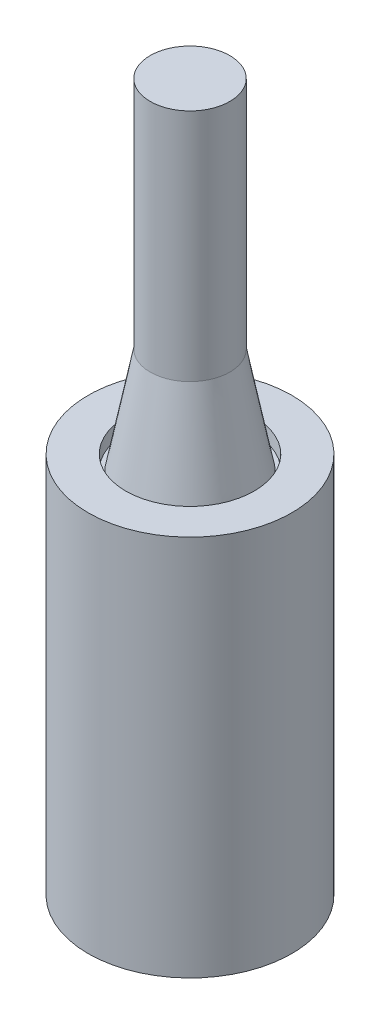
SolidWorks part; units mm, degrees
ref_plane "Front" through (0, 0, 0) normal (0, 0, 1) x (1, 0, 0)
ref_plane "Top" through (0, 0, 0) normal (0, 1, 0) x (1, 0, 0)
ref_plane "Right" through (0, 0, 0) normal (1, 0, 0) x (0, 0, -1)
sketch "Sketch1" plane through (0, 0, 0) normal (0, 1, 0) x (1, 0, 0)
  circle A1 centre (0, 0) radius 7.75
  dimension "D1" = 15.5
extrude "Extrude1" add sketch "Sketch1" along normal blind 18.923
sketch "Sketch2" plane through (0, 18.923, 0) normal (0, 1, 0) x (1, 0, 0)
  circle A0 centre (0, 0) radius 6.55
  dimension "D1" = 13.1
extrude "Extrude2" add sketch "Sketch2" along normal blind 11.43 draft 11
sketch "Sketch3" plane through (0, 30.353, 0) normal (0, 1, 0) x (1, 0, 0)
  circle A1 centre (0, 0) radius 4.3282
  circle A2 centre (0, 0) radius 4.3282
  dimension "D1" = 0
extrude "Extrude3" add sketch "Sketch3" along normal blind 25.5
sketch "Sketch4" plane through (0, 0, 0) normal (0, -1, 0) x (1, 0, 0)
  circle A1 centre (3.81, 0) radius 2.3114
  circle A2 centre (-3.81, 0) radius 2.3114
  circle A4 centre (0, 3.8481) radius 1.5875 construction
  dimension "D1" = 4.6228
  dimension "D2" = 7.747
  dimension "D4" = 12.2428
  dimension "D6" = 3.175
  dimension "D3" = 3.81
extrude "Extrude4" add sketch "Sketch4" along normal blind 6.35
sketch "Sketch5" plane through (0, -6.35, 0) normal (0, -1, 0) x (1, 0, 0)
  circle A0 centre (-3.81, 0) radius 1.3716
  circle A1 centre (3.81, 0) radius 1.3716
  dimension "D1" = 2.7432
extrude "Extrude5" add sketch "Sketch5" along normal blind 6.35
sketch "Sketch6" plane through (0, 0, 0) normal (0, -1, 0) x (1, 0, 0)
  circle A0 centre (0, 3.8481) radius 1.5875 construction
  circle A1 centre (0, 3.8481) radius 1.5875
extrude "Extrude6" add sketch "Sketch6" along normal up to surface (12.7 mm away)
sketch "Sketch7" plane through (0, 0, 0) normal (0, 0, 1) x (1, 0, 0)
  line L0 (6.985, 18.923) -> (8.1534, 18.923)
  line L1 (8.1534, 18.923) -> (8.1534, -21.0519)
  line L2 (8.1534, -21.0519) -> (11.0744, -21.0519)
  line L3 (11.0744, -21.0519) -> (11.0744, 20.4771)
  line L4 (11.0744, 20.4771) -> (6.985, 20.4771)
  line L5 (6.985, 20.4771) -> (6.985, 18.923)
  line L6 (0, 0) -> (0, -17.5468) construction
  line L7 (7.75, 18.923) -> (-7.75, 18.923) construction
  dimension "D1" = 22.1488
  dimension "D2" = 2.921
  dimension "D3" = 13.97
  dimension "D4" = 41.529
  dimension "D5" = 1.5541
revolve "LockRing" add sketch "Sketch7" angle 360 about L6
